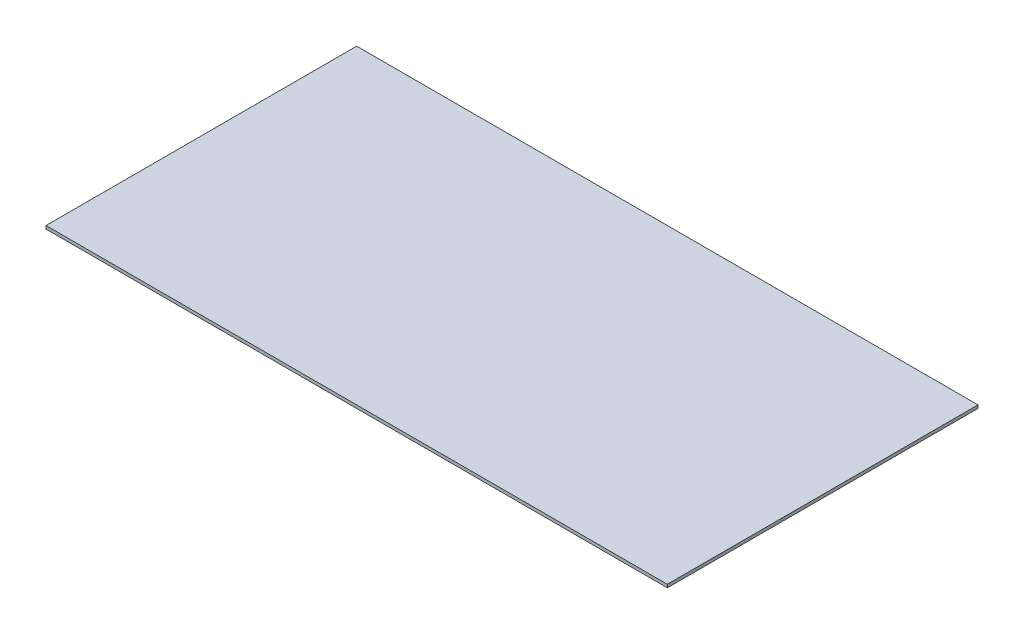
SolidWorks part; units mm, degrees
ref_plane "Plan de face" through (0, 0, 0) normal (0, 0, 1) x (1, 0, 0)
ref_plane "Plan de dessus" through (0, 0, 0) normal (0, 1, 0) x (1, 0, 0)
ref_plane "Plan de droite" through (0, 0, 0) normal (1, 0, 0) x (0, 0, -1)
sketch "Esquisse1" plane through (0, 0, 0) normal (0, 1, 0) x (1, 0, 0)
  line L1 (-2000, 500) -> (0, 500)
  line L2 (-2000, 500) -> (-2000, -500)
  line L3 (-2000, -500) -> (0, -500)
  line L4 (0, 500) -> (0, -500)
  dimension "D1" = 1000
  dimension "D2" = 2000
  dimension "D3" = 500
extrude "Extrusion1" add sketch "Esquisse1" along normal blind 10
